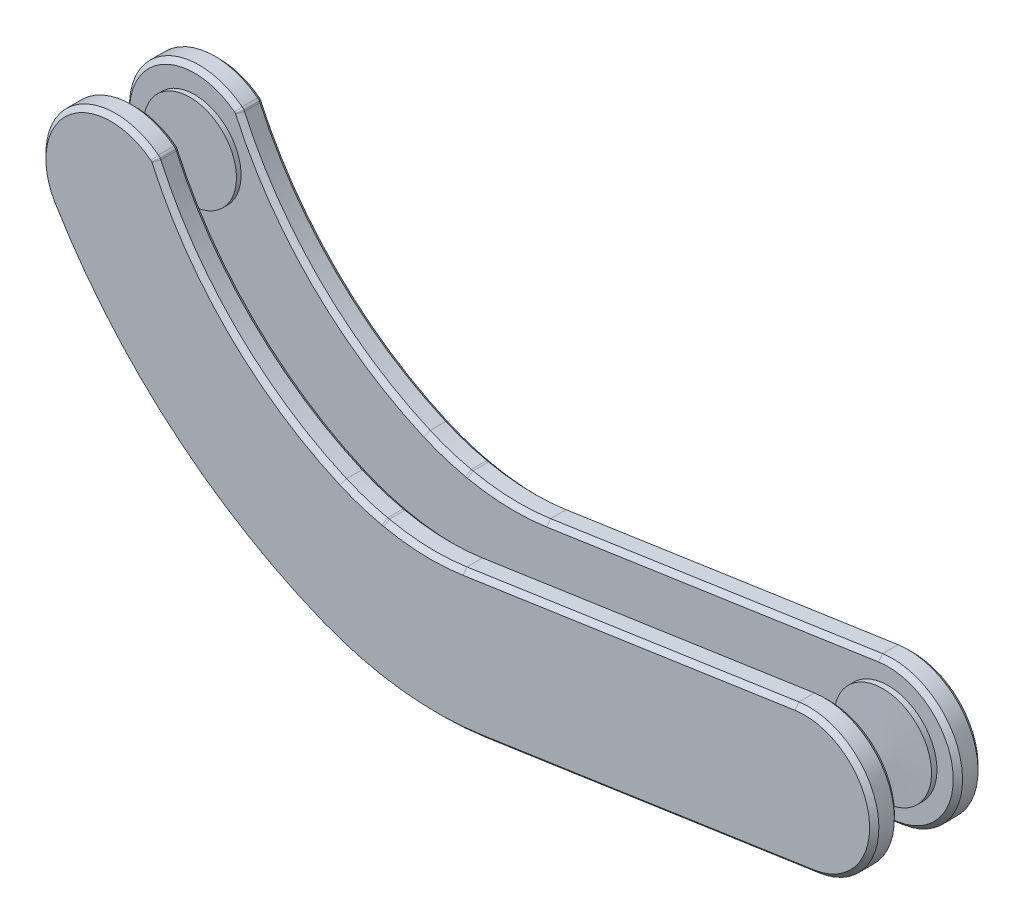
SolidWorks part; units mm, degrees
ref_plane "Front" through (0, 0, 0) normal (0, 0, 1) x (1, 0, 0)
ref_plane "Top" through (0, 0, 0) normal (0, 1, 0) x (1, 0, 0)
ref_plane "Right" through (0, 0, 0) normal (1, 0, 0) x (0, 0, -1)
imported_body "Defeature ausgeführt1"
imported_body "Defeature ausgeführt2"
imported_body "Defeature ausgeführt3"
imported_body "Defeature ausgeführt4"
imported_body "Defeature ausgeführt5"
imported_body "Defeature ausgeführt6"
other "Fläche löschen1"
other "Fläche löschen2"
